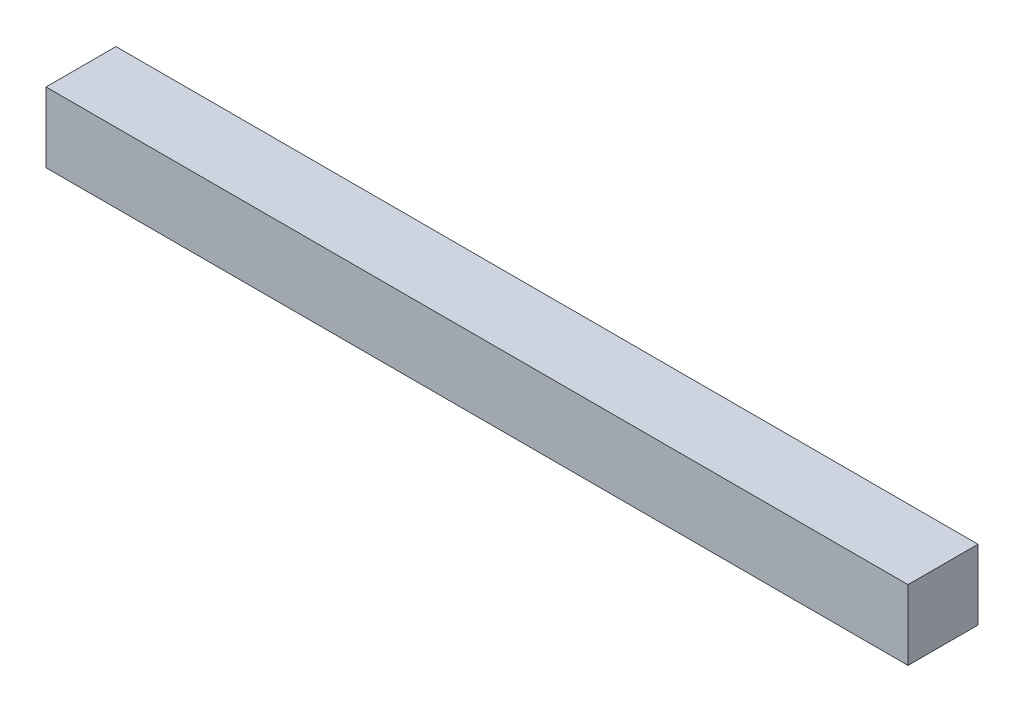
SolidWorks part; units mm, degrees
ref_plane "Piano frontale" through (0, 0, 0) normal (0, 0, 1) x (1, 0, 0)
ref_plane "Piano superiore" through (0, 0, 0) normal (0, 1, 0) x (1, 0, 0)
ref_plane "Piano destro" through (0, 0, 0) normal (1, 0, 0) x (0, 0, -1)
sketch "Sketch1" plane through (0, 0, 0) normal (0, 0, 1) x (1, 0, 0)
  line L1 (-13.1249, -3.6686) -> (11.5151, -3.6686)
  line L2 (-13.1249, -3.6686) -> (-13.1249, -1.6686)
  line L3 (-13.1249, -1.6686) -> (11.5151, -1.6686)
  line L4 (11.5151, -3.6686) -> (11.5151, -1.6686)
  dimension "D1" = 24.64
  dimension "D2" = 2
extrude "Boss-Extrude1" add sketch "Sketch1" along normal blind 2
